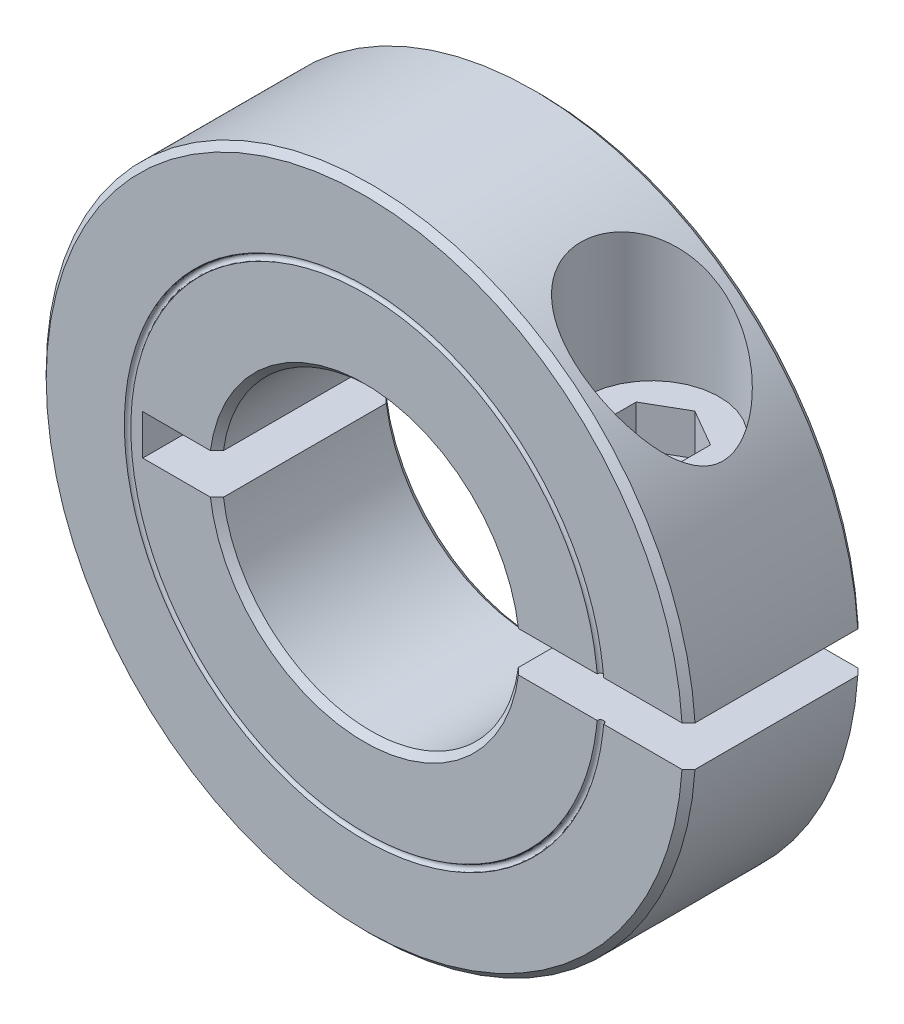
SolidWorks part; units mm, degrees
other "LUMP1"
ref_plane "Front" through (0, 0, 0) normal (0, 0, 1) x (1, 0, 0)
ref_plane "Top" through (0, 0, 0) normal (0, 1, 0) x (1, 0, 0)
ref_plane "Right" through (0, 0, 0) normal (1, 0, 0) x (0, 0, -1)
imported_body "Imported1"
move or copy body "Body-Move/Copy1" bodies to move or copy 101 placed by mates yes
ref_plane "Z Location" through (0, 0, 37.4523) normal (0, 0, 1) x (1, 0, 0)
sketch "Y Location" plane through (0, 0, 37.4523) normal (0, 0, 1) x (1, 0, 0)
  line L0 (0, 0) -> (0, 94.1426) construction
  dimension "BD71" = 94.1426
move or copy body "Body-Move/Copy2" bodies to move or copy 101 placed by mates yes
other "Distance1" parameters "D1"=5.1562
